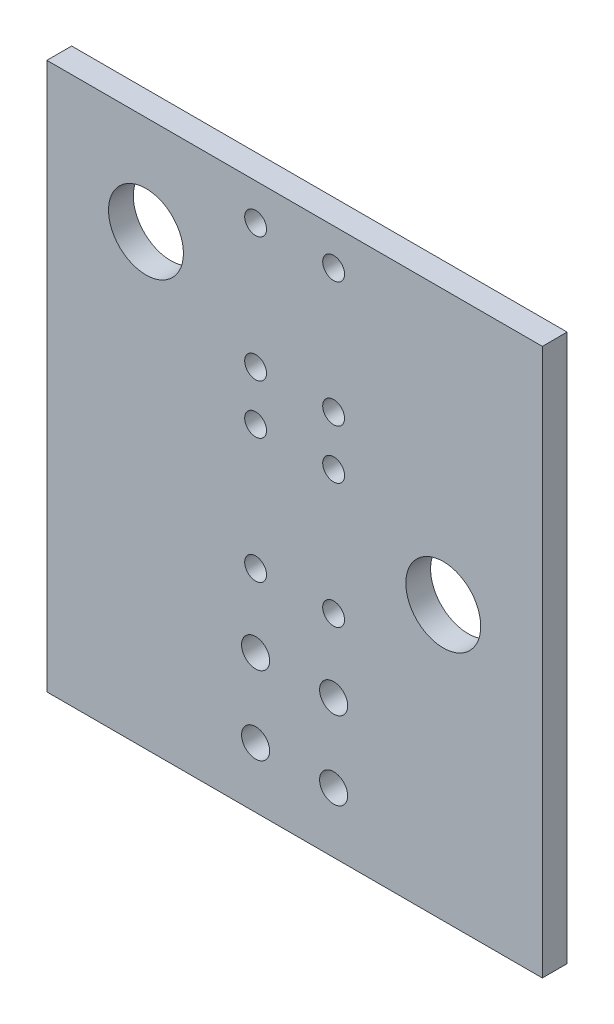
SolidWorks part; units mm, degrees
other "<EE-SX1103>-<Boss-Extrude2>"
ref_plane "Front" through (0, 0, 0) normal (0, 0, 1) x (1, 0, 0)
ref_plane "Top" through (0, 0, 0) normal (0, 1, 0) x (1, 0, 0)
ref_plane "Right" through (0, 0, 0) normal (1, 0, 0) x (0, 0, -1)
sketch "Sketch1" plane through (0, 0, 0) normal (0, 0, 1) x (1, 0, 0)
  line L1 (-7.9375, 0) -> (7.9375, 0)
  line L2 (-7.9375, 0) -> (-7.9375, -17.526)
  line L3 (-7.9375, -17.526) -> (7.9375, -17.526)
  line L4 (7.9375, 0) -> (7.9375, -17.526)
  point P4 (0, 0)
  dimension "D1" = 15.875
  dimension "D2" = 17.526
extrude "Boss-Extrude1" add sketch "Sketch1" along normal blind 0.7937
hole_wizard "Ø0.7 (0.7) Diameter Hole1" positions "Sketch4" profile "Sketch5" hole size "Ø0.7" standard "ANSI Metric"
sketch "Sketch4" plane through (0, 0, 0.7937) normal (0, 0, 1) x (1, 0, 0)
  line L0 (-1.25, -1.1684) -> (-1.25, -5.1684)
  line L1 (-1.25, -5.1684) -> (1.25, -5.1684)
  line L2 (1.25, -5.1684) -> (1.25, -1.1684)
  line L3 (1.25, -1.1684) -> (-1.25, -1.1684)
  line L7 (0, 0) -> (0, -1.1684)
  line L8 (7.9375, 0) -> (-7.9375, 0) construction
  point P0 (-1.25, -1.1684)
  point P2 (1.25, -1.1684)
  point P4 (-1.25, -5.1684)
  point P6 (1.25, -5.1684)
  dimension "D1" = 4
  dimension "D2" = 2.5
  dimension "D3" = 1.1684
sketch "Sketch5" plane through (-1.25, -1.1684, 0.7937) normal (1, 0, 0) x (0, -1, 0)
  line L0 (0, 0) -> (0, 0.7938)
  line L1 (0, 0.7938) -> (0.35, 0.7938)
  line L2 (0.35, 0.7938) -> (0.35, 0)
  line L5 (0.35, 0) -> (0, 0)
  line L11 (0, -6.35) -> (0, 107.95) construction
  dimension "Thru Hole Dia." = 0.7
  dimension "Thru Hole Depth" = 0.7937
pattern_linear "LPattern1" count 2 spacing 5.588 along (0, -1, 0) of "Ø0.7 (0.7) Diameter Hole1"
hole_wizard "M2 Clearance Hole1" positions "Sketch2" profile "Sketch3" hole size "M2" standard "ANSI Metric"
sketch "Sketch2" plane through (0, 0, 0.7937) normal (0, 0, 1) x (1, 0, 0)
  line L0 (0, 0) -> (0, -17.526)
  line L1 (-7.9375, -17.526) -> (7.9375, -17.526) construction
  line L3 (-4.7625, -3.1684) -> (4.7625, -8.7564)
  line L16 (-1.25, -1.1684) -> (1.25, -5.1684)
  point P0 (-4.7625, -3.1684)
  point P2 (4.7625, -8.7564)
  point P16 (0, -5.9624)
  point P53 (0, -3.1684)
  dimension "D1" = 5.588
  dimension "D2" = 9.525
sketch "Sketch3" plane through (-4.7625, -3.1684, 0.7937) normal (1, 0, 0) x (0, -1, 0)
  line L0 (0, 0) -> (0, 0.7938)
  line L1 (0, 0.7938) -> (1.2, 0.7938)
  line L2 (1.2, 0.7938) -> (1.2, 0)
  line L5 (1.2, 0) -> (0, 0)
  line L11 (0, -6.35) -> (0, 107.95) construction
  dimension "Thru Hole Dia." = 2.4
  dimension "Thru Hole Depth" = 0.7938
hole_wizard "Ø0.9 (0.9) Diameter Hole1" positions "Sketch7" profile "Sketch8" hole size "Ø0.9" standard "ANSI Metric"
sketch "Sketch7" plane through (0, 0, 0.7937) normal (0, 0, 1) x (1, 0, 0)
  line L0 (1.25, -13.0944) -> (1.25, -15.5944)
  line L1 (1.25, -15.5944) -> (-1.25, -15.5944)
  line L2 (-1.25, -15.5944) -> (-1.25, -13.0944)
  line L3 (-1.25, -13.0944) -> (1.25, -13.0944)
  point P0 (-1.25, -13.0944)
  point P2 (1.25, -13.0944)
  point P4 (1.25, -15.5944)
  point P6 (-1.25, -15.5944)
  point P22 (1.25, -14.3444)
  point P23 (0, -13.0944)
  dimension "D1" = 5.588
  dimension "D2" = 2.5
sketch "Sketch8" plane through (-1.25, -13.0944, 0.7937) normal (1, 0, 0) x (0, -1, 0)
  line L0 (0, 0) -> (0, 0.7938)
  line L1 (0, 0.7938) -> (0.45, 0.7938)
  line L2 (0.45, 0.7938) -> (0.45, 0)
  line L5 (0.45, 0) -> (0, 0)
  line L11 (0, -6.35) -> (0, 107.95) construction
  dimension "Thru Hole Dia." = 0.9
  dimension "Thru Hole Depth" = 0.7938
inserted part "EE-SX1103"
move or copy body "Body-Move/Copy2" placed by mates yes parameters "D1"=0, "D2"=0, "D3"=0
pattern_linear "LPattern2" count 2 spacing 5.588 along (0, -1, 0)
ref_plane "Plane1" through (0, -5.9624, 0) normal (0, -1, 0) x (-1, 0, 0)
delete or keep bodies "Body-Delete/Keep 1" type keep bodies bodies 108
